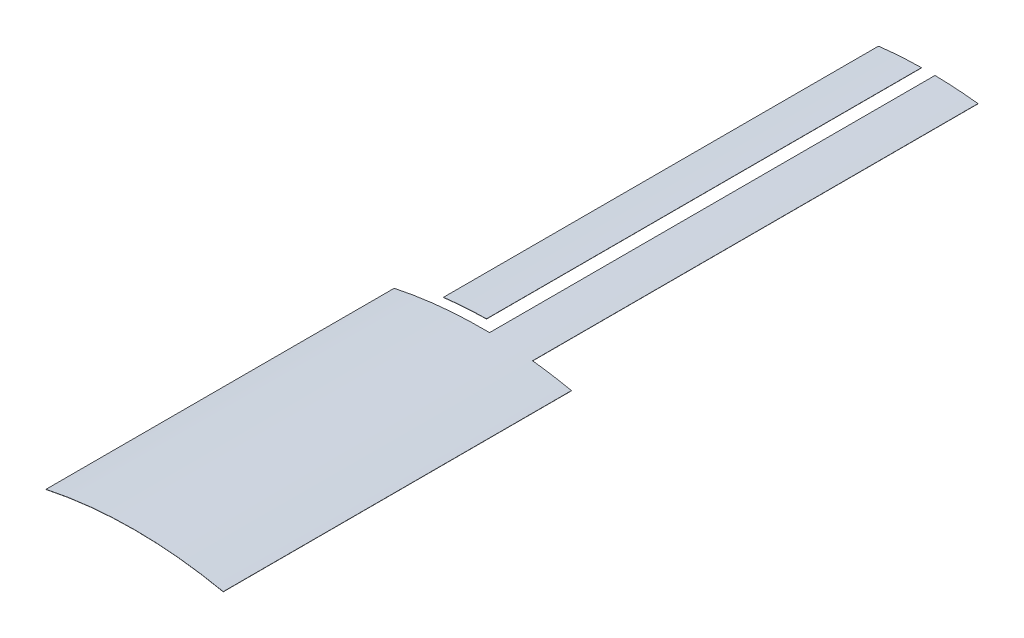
SolidWorks part; units mm, degrees
ref_plane "Front Plane" through (0, 0, 0) normal (0, 0, 1) x (1, 0, 0)
ref_plane "Top Plane" through (0, 0, 0) normal (0, 1, 0) x (1, 0, 0)
ref_plane "Right Plane" through (0, 0, 0) normal (1, 0, 0) x (0, 0, -1)
sketch "Sketch1" plane through (0, 0, 0) normal (0, 0, 1) x (1, 0, 0)
  line L0 (0, 0) -> (0, 29.185) construction
  line L1 (-6.35, 28.4164) -> (6.35, 28.4164) construction
  line L2 (-6.35, 28.4164) -> (-6.35, 23.4882) construction
  line L3 (-6.35, 23.4882) -> (6.35, 23.4882) construction
  line L4 (6.35, 28.4164) -> (6.35, 23.4882) construction
  line L5 (-6.35, 26.0991) -> (-6.35, 26.086)
  line L6 (6.35, 26.0991) -> (6.35, 26.086)
  circle A0 centre (0, 0) radius 26.8605 construction
  circle A1 centre (0, 0) radius 26.8478 construction
  arc A2 (-6.35, 26.0991) -> (6.35, 26.0991) centre (0, 0) cw
  arc A3 (6.35, 26.086) -> (-6.35, 26.086) centre (0, 0) ccw
  dimension "D1" = 53.721
  dimension "D2" = 53.6956
  dimension "D3" = 12.7
  dimension "D4" = 6.35
extrude "Extrude1" add sketch "Sketch1" along normal blind 50.8
sketch "Sketch2" plane through (0, 0, 0) normal (0, 1, 0) x (1, 0, 0)
  line L0 (-3.6654, 0) -> (-3.4096, 1.0442)
  line L1 (-3.4096, 1.0442) -> (3.1374, 1.0442)
  line L2 (-3.6654, 0) -> (-3.6654, -25.4)
  line L3 (-6.35, -28.0846) -> (-6.35, 2.0561)
  line L4 (3.6654, 0) -> (3.6654, -25.4)
  line L5 (-3.6654, -25.4) -> (-6.35, -28.0846)
  line L6 (-6.35, -50.8) -> (-6.35, 0) construction
  line L7 (3.6654, -25.4) -> (6.35, -28.0846)
  line L8 (6.35, -50.8) -> (6.35, 0) construction
  line L9 (-6.35, -28.0846) -> (12.6785, -28.0846) construction
  line L10 (-6.35, 2.0561) -> (6.35, 2.0561)
  line L11 (6.35, 2.0561) -> (6.35, -28.0846)
  line L12 (-6.35, -50.8) -> (6.35, -50.8) construction
  line L13 (-6.35, -28.0846) -> (-6.35, -50.8)
  line L14 (-5.588, -28.0846) -> (-5.588, -50.038)
  line L15 (-5.588, -50.038) -> (5.588, -50.038)
  line L16 (5.588, -28.0846) -> (5.588, -50.038)
  line L17 (0, 3.5661) -> (0, -32.267) construction
  line L18 (0.4247, 0.0388) -> (3.1374, 0.0388)
  line L19 (0.4247, 0.0388) -> (0.4247, -28.0846)
  line L20 (-6.35, -50.8) -> (6.35, -50.8)
  line L21 (3.1374, 0.0388) -> (3.1374, -28.0846)
  line L22 (-0.4247, 0.0388) -> (-0.4247, -27.4249)
  line L23 (-3.1374, 0.0388) -> (-3.1374, -27.4249)
  line L24 (-0.4247, -27.4249) -> (-3.1374, -27.4249)
  line L25 (-0.4247, 0.0388) -> (-3.1374, 0.0388)
  line L26 (3.1374, 1.0442) -> (3.6654, 0)
  line L27 (0.4247, -28.0846) -> (-5.588, -28.0846)
  line L28 (3.1374, -28.0846) -> (5.588, -28.0846)
  line L29 (6.35, -50.8) -> (6.35, -28.0846)
  line L30 (6.35, -28.0846) -> (6.35, -50.8)
  dimension "D1" = 25.4
  dimension "D2" = 135
  dimension "D3" = 135
  dimension "D4" = 0.762
  dimension "D5" = 0.762
  dimension "D6" = 0.762
extrude "Cut-Extrude2" cut sketch "Sketch2" along normal blind 50.8 contours L29 L7 L4 L26 L1 L0 L2 L5 L13 L20 L28 L16 L15 L14 L27 L19 L18 L21 L23 L25 L22 L24
